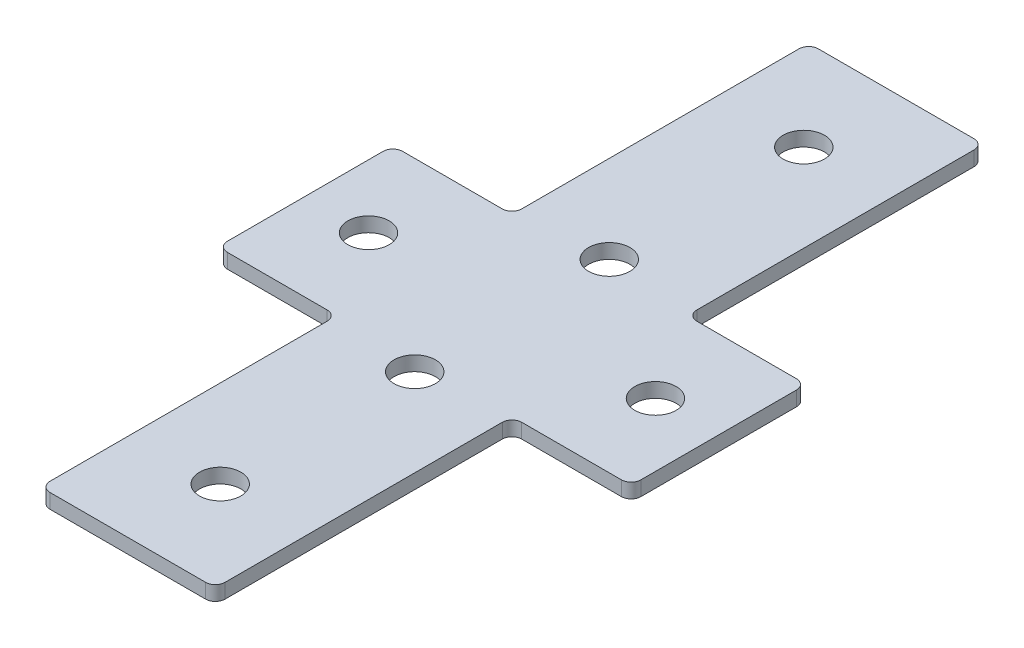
SolidWorks part; units mm, degrees
ref_plane "前视基准面" through (0, 0, 0) normal (0, 0, 1) x (1, 0, 0)
ref_plane "上视基准面" through (0, 0, 0) normal (0, 1, 0) x (1, 0, 0)
ref_plane "右视基准面" through (0, 0, 0) normal (1, 0, 0) x (0, 0, -1)
sketch "草图1" plane through (0, 0, 0) normal (0, 1, 0) x (1, 0, 0)
  line L0 (-77.2767, 0) -> (100.7239, 0) construction
  line L1 (0, 102.0449) -> (0, -103.6961) construction
  line L2 (-18, 79) -> (18, 79)
  line L3 (-42.5, -18) -> (-42.5, 18)
  line L4 (-42.5, 18) -> (-18, 18)
  line L5 (-18, 18) -> (-18, 79)
  line L6 (-42.5, -18) -> (-18, -18)
  line L7 (-18, -18) -> (-18, -79)
  line L8 (18, -18) -> (18, -79)
  line L9 (42.5, -18) -> (18, -18)
  line L10 (18, 18) -> (18, 79)
  line L11 (42.5, 18) -> (18, 18)
  line L12 (42.5, -18) -> (42.5, 18)
  line L13 (-18, -79) -> (18, -79)
  circle A0 centre (0, 60) radius 4.25
  circle A1 centre (0, 20) radius 4.25
  circle A2 centre (0, -20) radius 4.25
  circle A3 centre (0, -60) radius 4.25
  circle A4 centre (-29.5, 0) radius 4.25
  circle A5 centre (29.5, 0) radius 4.25
  dimension "D4" = 59
  dimension "D6" = 8.5
  dimension "D7" = 8.5
  dimension "D8" = 29.5
  dimension "D1" = 36
  dimension "D2" = 158
  dimension "D3" = 85
  dimension "D5" = 19
extrude "凸台-拉伸1" add sketch "草图1" along normal blind 3
fillet "圆角1" radius 2 12 edges at (-18, 1.5, 79) (18, 1.5, 79) (42.5, 1.5, 18) (18, 1.5, 18) (-18, 1.5, 18) (-42.5, 1.5, 18) (-18, 1.5, -18) (18, 1.5, -18) (42.5, 1.5, -18) (-42.5, 1.5, -18) (18, 1.5, -79) (-18, 1.5, -79)
